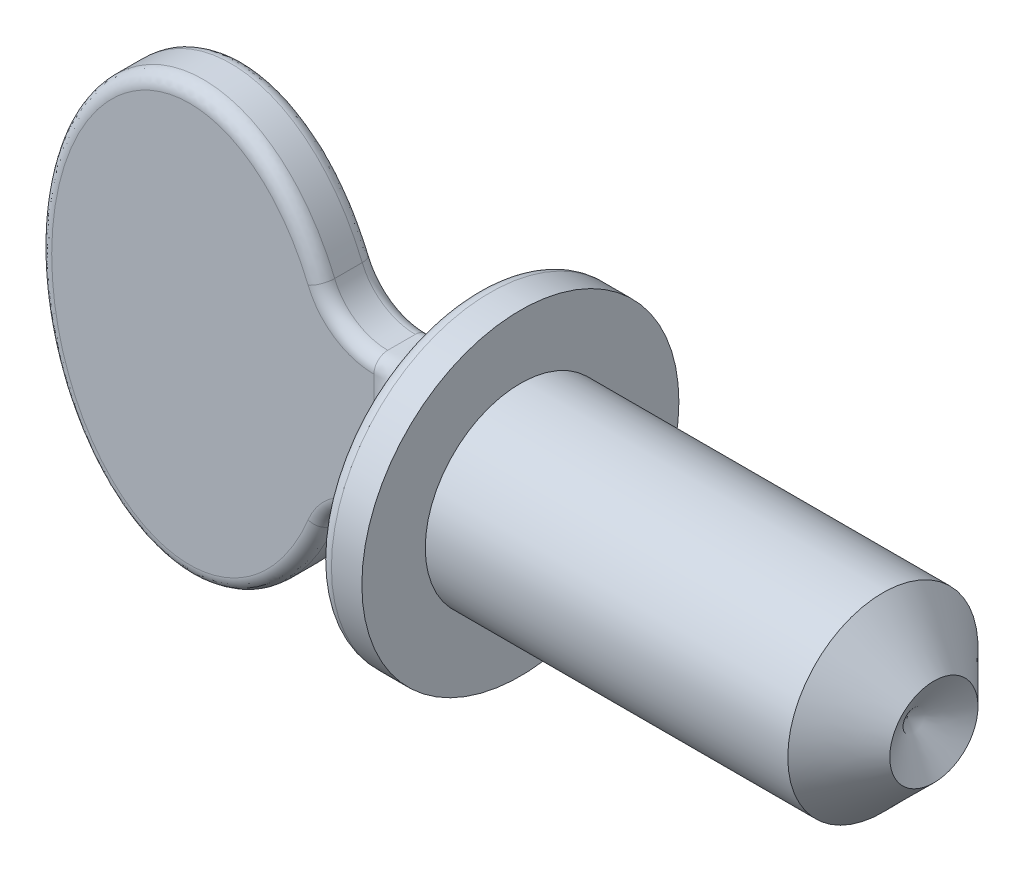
SolidWorks part; units mm, degrees
ref_plane "Front Plane" through (0, 0, 0) normal (0, 0, 1) x (1, 0, 0)
ref_plane "Top Plane" through (0, 0, 0) normal (0, 1, 0) x (1, 0, 0)
ref_plane "Right Plane" through (0, 0, 0) normal (1, 0, 0) x (0, 0, -1)
sketch "layout" plane through (0, 0, 0) normal (0, 0, 1) x (1, 0, 0)
  line L0 (0, 0) -> (13.208, 0) construction
  line L1 (5.588, 2.921) -> (5.588, -2.921)
  line L2 (3.3976, 1.3123) -> (4.8921, 1.3123) construction
  line L3 (5.588, 2.921) -> (4.7897, 2.921)
  line L4 (4.7897, 2.921) -> (4.7897, 3.2655) construction
  line L5 (4.2865, 1.706) -> (4.2865, 0)
  line L6 (4.2865, 1.706) -> (3.3355, 0.7551) construction
  line L7 (13.208, 1.7526) -> (13.208, 0)
  line L8 (3.3976, 1.3123) -> (3.3976, -1.3123)
  line L9 (13.208, 1.7526) -> (5.588, 1.7526)
  arc A0 (3.3976, 1.3123) -> (2.4197, 1.9685) centre (3.3976, 2.3692) cw
  arc A1 (4.7897, 2.921) -> (4.2865, 1.706) centre (3.0715, 2.921) cw
  arc A2 (3.3976, -1.3123) -> (2.4197, -1.9685) centre (3.3976, -2.3692) ccw
  ellipse E0 centre (0, 0) end of major axis (0, 3.937) minor radius 2.794 (2.4197, 1.9685) -> (2.4197, -1.9685) ccw
  dimension "Head Width" = 7.874
  dimension "Shoulder Dia" = 5.842
  dimension "Head Height" = 8.382
  dimension "D4" = 5.588
  dimension "D5" = 2.6247
  dimension "D6" = 3.937
  dimension "D7" = 3.4121
  dimension "D8" = 0.7983
  dimension "D9" = 45
  dimension "Length" = 7.62
  dimension "Base Screw Dia" = 3.5052
sketch "Sketch3" plane through (0, 0, 0) normal (0, 0, 1) x (1, 0, 0)
  line L0 (3.3976, 1.3123) -> (3.3976, -1.3123) construction
  line L1 (3.3976, 1.3123) -> (3.3976, -1.3123)
  arc A0 (3.3976, -1.3123) -> (2.4197, -1.9685) centre (3.3976, -2.3692) ccw construction
  arc A1 (2.4197, 1.9685) -> (3.3976, 1.3123) centre (3.3976, 2.3692) ccw construction
  arc A2 (3.3976, -1.3123) -> (2.4197, -1.9685) centre (3.3976, -2.3692) ccw
  arc A3 (2.4197, 1.9685) -> (3.3976, 1.3123) centre (3.3976, 2.3692) ccw
  ellipse E0 centre (0, 0) end of major axis (0, 3.937) minor radius 2.794 (2.4197, 1.9685) -> (2.4197, -1.9685) ccw construction
  ellipse E1 centre (0, 0) end of major axis (0, 3.937) minor radius 2.794 (2.4197, 1.9685) -> (2.4197, -1.9685) ccw
extrude "Extrude1" add sketch "Sketch3" along normal mid plane 1.016
fillet "Fillet1" radius 0.254 6 edges at (2.8088, 1.4916, -0.508) (2.8088, -1.4916, -0.508) (2.8088, 1.4916, 0.508) (2.8088, -1.4916, 0.508) (-2.794, 0, -0.508) (-2.794, 0, 0.508)
sketch "Sketch4" plane through (0, 0, 0) normal (0, 0, 1) x (1, 0, 0)
  line L0 (13.208, 1.7526) -> (13.208, 0) construction
  line L1 (13.208, 1.7526) -> (5.588, 1.7526) construction
  line L2 (5.588, 2.921) -> (5.588, -2.921) construction
  line L3 (5.588, 2.921) -> (4.7897, 2.921) construction
  line L4 (4.2865, 1.706) -> (4.2865, 0) construction
  line L5 (13.208, 0.8128) -> (13.208, 0) construction
  line L6 (12.2682, 1.7526) -> (5.588, 1.7526)
  line L7 (5.588, 2.921) -> (5.588, 1.7526)
  line L8 (5.588, 2.921) -> (4.7897, 2.921)
  line L9 (4.2865, 1.706) -> (4.2865, 0)
  line L10 (0, 0) -> (16.8942, 0) construction
  line L11 (12.7196, 0) -> (4.2865, 0)
  line L12 (12.2682, 1.7526) -> (13.208, 0.8128)
  line L13 (13.208, 0.8128) -> (12.7196, 0)
  line L14 (13.208, -0.8128) -> (12.7196, 0) construction
  line L15 (12.2682, -1.7526) -> (13.208, -0.8128) construction
  arc A0 (4.2865, 1.706) -> (4.7897, 2.921) centre (3.0715, 2.921) ccw construction
  arc A1 (4.2865, 1.706) -> (4.7897, 2.921) centre (3.0715, 2.921) ccw
  dimension "O" = 1.6256
  dimension "D2" = 118
  dimension "D3" = 90
revolve "Revolve1" add sketch "Sketch4" angle 360 about L10
loft "Loft1" add
fillet "Fillet2" radius 0.254 1 edges at (4.7897, 0, 2.921)
sketch "Sketch5" plane through (0, 0, 0) normal (0, 1, 0) x (1, 0, 0)
  line L0 (11.7227, 2.2981) -> (12.2682, 2.2981)
  line L1 (12.2682, 2.2981) -> (12.2682, 1.7526)
  line L2 (12.2682, 1.7526) -> (11.9954, 1.2802)
  line L3 (11.9954, 1.2802) -> (11.7227, 1.7526)
  line L4 (12.2682, -1.7526) -> (12.2682, 1.7526) construction
  line L5 (11.7227, 1.7526) -> (11.7227, 2.2981)
  line L7 (-3.6147, 0) -> (14.1406, 0) construction
  line L8 (12.2682, 1.7526) -> (5.588, 1.7526) construction
  dimension "D1" = 0.4724
revolve "Cut-Revolve10" [suppressed] cut sketch "Sketch5" angle 360 about L7
pattern_linear "LPattern10" [suppressed] count 8 along (1, 0, 0)
equation "\"D4@layout\" = \"Head Height@layout\" / 3 * 2"
equation "\"D5@layout\" = \"Head Width@layout\" / 3"
equation "\"D6@layout\" = \"Head Width@layout\" / 2"
equation "\"D7@layout\" = \"D5@layout\" * 1.3"
equation "\"D8@layout\" = \"D4@layout\"  / 7"
equation "\"D1@Fillet1\" = \"Head Thickness@Extrude1\" / 4"
equation "\"D1@Fillet2\" = \"D1@Fillet1\""
equation "\"D1@Sketch5\" = ( \"Base Screw Dia@layout\"- \"Minor Dia@Cosmetic Thread1\" )  / 2"
equation "\"D1@LPattern10\" = int((\"Length@layout\"-\"O@Sketch4\"/2)/\"Advance@LPattern10\")"
